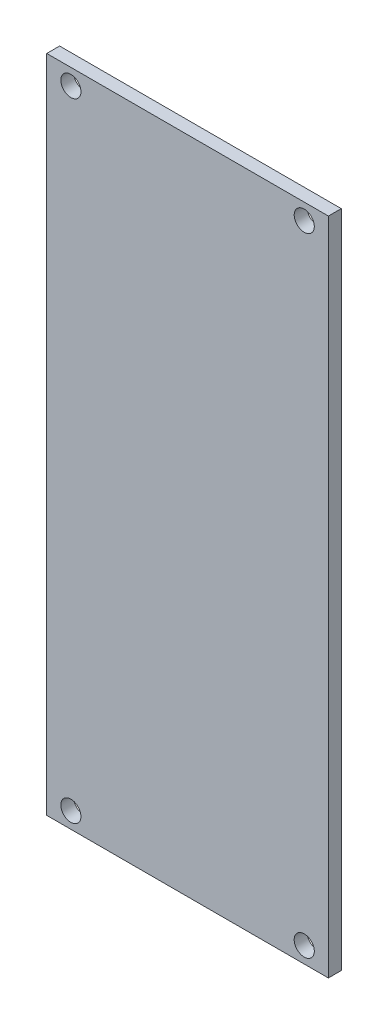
SolidWorks part; units mm, degrees
ref_plane "Front" through (0, 0, 0) normal (0, 0, 1) x (1, 0, 0)
ref_plane "Top" through (0, 0, 0) normal (0, 1, 0) x (1, 0, 0)
ref_plane "Right" through (0, 0, 0) normal (1, 0, 0) x (0, 0, -1)
sketch "Sketch1" plane through (0, 0, 0) normal (0, 0, 1) x (1, 0, 0)
  line L1 (0, 0) -> (44.45, 0)
  line L2 (0, 0) -> (0, 104.14)
  line L3 (0, 104.14) -> (44.45, 104.14)
  line L4 (44.45, 0) -> (44.45, 104.14)
  dimension "D1" = 104.14
  dimension "D2" = 44.45
extrude "Base-Extrude" add sketch "Sketch1" against normal blind 2.032
sketch "Sketch2" plane through (0, 0, 0) normal (0, 0, 1) x (1, 0, 0)
  line L0 (-11.2188, 101.6) -> (59.0072, 101.6) construction
  line L1 (-15.1533, 2.54) -> (52.4496, 2.54) construction
  line L2 (3.81, 106.1501) -> (3.81, -6.6406) construction
  line L3 (40.64, 106.1501) -> (40.64, -6.6406) construction
  line L4 (0, 0) -> (44.45, 0) construction
  line L6 (0, 104.14) -> (0, 0) construction
  line L8 (44.45, 104.14) -> (0, 104.14) construction
  circle A0 centre (3.81, 101.6) radius 1.5875
  circle A1 centre (40.64, 101.6) radius 1.5875
  circle A2 centre (3.81, 2.54) radius 1.5875
  circle A3 centre (40.64, 2.54) radius 1.5875
  dimension "D1" = 99.06
  dimension "D2" = 2.54
  dimension "D3" = 36.83
  dimension "D4" = 3.81
  dimension "D5" = 3.175
  dimension "D6" = 3.175
  dimension "D7" = 3.175
  dimension "D8" = 3.175
  dimension "D9" = 2.54
extrude "MOUNTING HOLES" cut sketch "Sketch2" against normal through all
